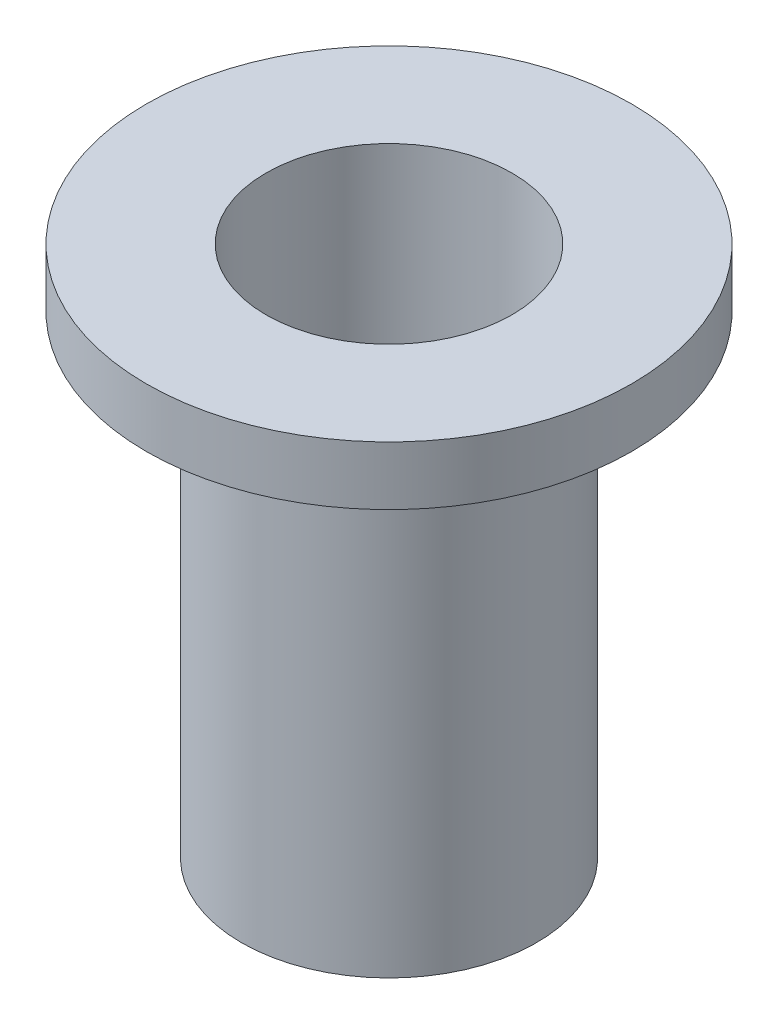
SolidWorks part; units mm, degrees
ref_plane "Front Plane" through (0, 0, 0) normal (0, 0, 1) x (1, 0, 0)
ref_plane "Top Plane" through (0, 0, 0) normal (0, 1, 0) x (1, 0, 0)
ref_plane "Right Plane" through (0, 0, 0) normal (1, 0, 0) x (0, 0, -1)
sketch "Sketch1" plane through (0, 0, 0) normal (0, 0, 1) x (1, 0, 0)
  line L0 (0, 63.9339) -> (0, -59.2618) construction
  line L1 (-3.302, 14.2748) -> (-3.302, 0)
  line L2 (-3.302, 0) -> (-3.9624, 0)
  line L3 (-3.9624, 0) -> (-3.9624, 12.7)
  line L4 (-3.9624, 12.7) -> (-6.5151, 12.7)
  line L5 (-6.5151, 12.7) -> (-6.5151, 14.2748)
  line L6 (-6.5151, 14.2748) -> (-3.302, 14.2748)
  dimension "D1" = 6.604
  dimension "D2" = 7.9248
  dimension "D3" = 13.0302
  dimension "D4" = 1.5748
  dimension "D5" = 12.7
revolve "Revolve1" add sketch "Sketch1" angle 360 about L0
